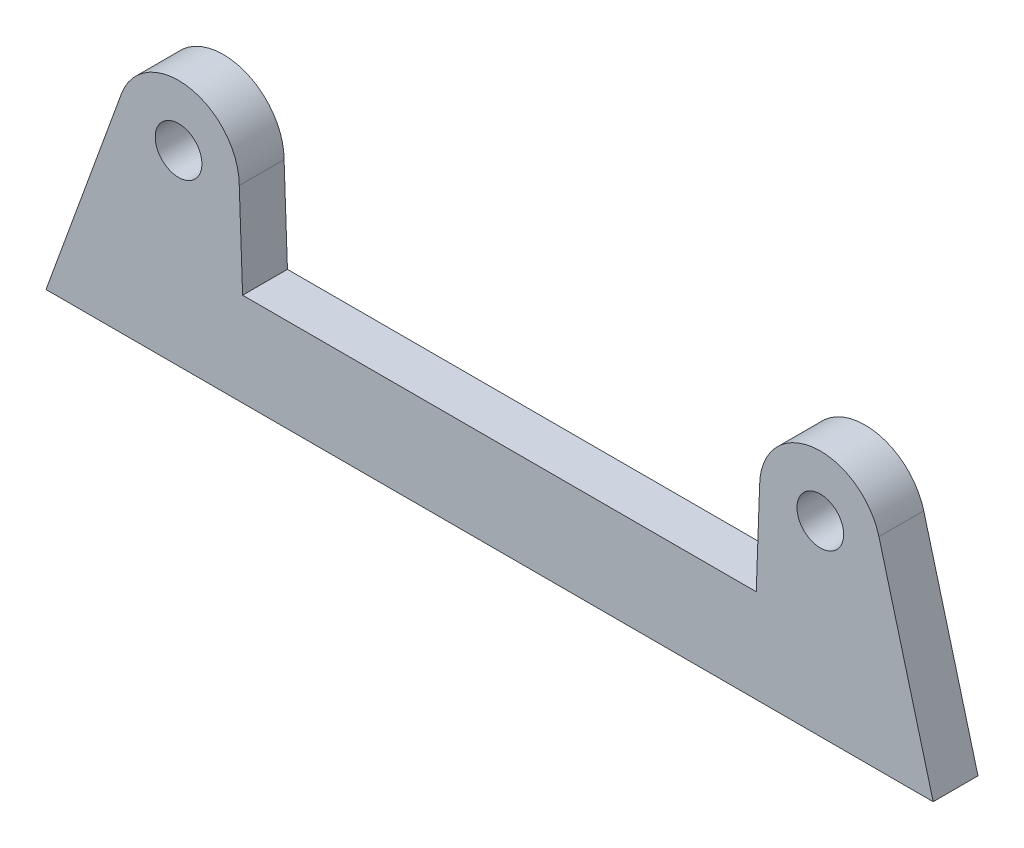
SolidWorks part; units mm, degrees
ref_plane "Front Plane" through (0, 0, 0) normal (0, 0, 1) x (1, 0, 0)
ref_plane "Top Plane" through (0, 0, 0) normal (0, 1, 0) x (1, 0, 0)
ref_plane "Right Plane" through (0, 0, 0) normal (1, 0, 0) x (0, 0, -1)
sketch "Sketch2" plane through (0, 0, 0) normal (0, 0, 1) x (1, 0, 0)
  line L0 (0, 0) -> (120.65, 0)
  line L1 (120.65, 0) -> (113.2738, 27.5283)
  line L2 (61.6634, 12.7) -> (61.6634, 52.0243) construction
  line L3 (97.0451, 25.3918) -> (96.5884, 12.7)
  line L4 (96.5884, 12.7) -> (26.7384, 12.7)
  line L5 (26.7384, 12.7) -> (26.2816, 25.3918)
  line L7 (10.2695, 28.2152) -> (0, 0)
  arc A0 (10.2695, 28.2152) -> (26.2816, 25.3918) centre (18.0266, 25.3918) cw
  circle A1 centre (18.0266, 25.3918) radius 3.175
  arc A2 (113.2738, 27.5283) -> (97.0451, 25.3918) centre (105.3001, 25.3918) ccw
  circle A3 centre (105.3001, 25.3918) radius 3.175
  dimension "D1" = 75
  dimension "D2" = 120.65
  dimension "D4" = 16.51
  dimension "D8" = 6.35
  dimension "D3" = 69.85
  dimension "D5" = 12.7
  dimension "D6" = 70
  dimension "D7" = 12.7
extrude "Extrude1" add sketch "Sketch2" against normal blind 6.096
sketch3d "3DSketch1"
  circle A3 centre (105.3001, 25.3918, -6.096) radius 3.175 construction
  circle A4 centre (105.3001, 25.3918, 0) radius 3.175 construction
  circle A5 centre (18.0266, 25.3918, 0) radius 3.175 construction
  circle A6 centre (18.0266, 25.3918, -6.096) radius 3.175 construction
  point P2 (105.3001, 25.3918, 0)
  point P3 (105.3001, 25.3918, -6.096)
  point P4 (105.3001, 25.3918, -2.921)
  point P7 (105.3001, 25.3918, 3.175)
  point P8 (18.0266, 25.3918, -6.096)
  point P9 (18.0266, 25.3918, 0)
  point P12 (18.0266, 25.3918, 3.175)
  point P15 (18.0266, 25.3918, -2.921)
